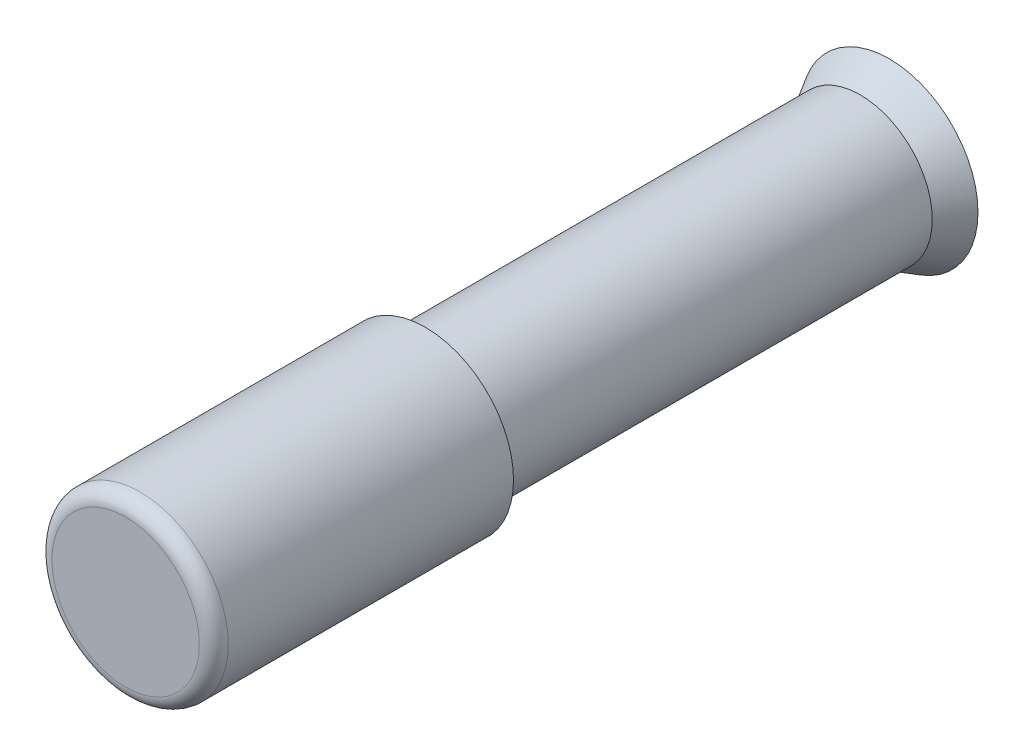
SolidWorks part; units mm, degrees
ref_plane "Спереди" through (0, 0, 0) normal (0, 0, 1) x (1, 0, 0)
ref_plane "Сверху" through (0, 0, 0) normal (0, 1, 0) x (1, 0, 0)
ref_plane "Справа" through (0, 0, 0) normal (1, 0, 0) x (0, 0, -1)
sketch "Эскиз1" plane through (0, 0, 0) normal (1, 0, 0) x (0, 0, -1)
  line L0 (0, 0) -> (39.9944, 0) construction
  line L1 (0, 0) -> (0, 2.0161)
  line L2 (0.3969, 2.413) -> (8.2042, 2.413)
  line L3 (8.2042, 2.413) -> (8.2042, 1.9685)
  line L4 (8.2042, 1.9685) -> (20.1105, 1.9685)
  line L5 (20.1105, 1.9685) -> (20.9042, 2.4268)
  line L7 (21.3862, 0) -> (0, 0)
  arc A0 (20.9042, 2.4268) -> (21.3862, 0) centre (15.0362, 0) cw
  arc A1 (0, 2.0161) -> (0.3969, 2.413) centre (0.3969, 2.0161) cw
  dimension "D5" = 6.35
  dimension "D8" = 0.3969
  dimension "D1" = 12.7
  dimension "D2" = 4.826
  dimension "D3" = 3.937
  dimension "D4" = 8.2042
  dimension "D6" = 30
  dimension "D7" = 0.7937
revolve "Повернуть1" add sketch "Эскиз1" angle 360 about L0
